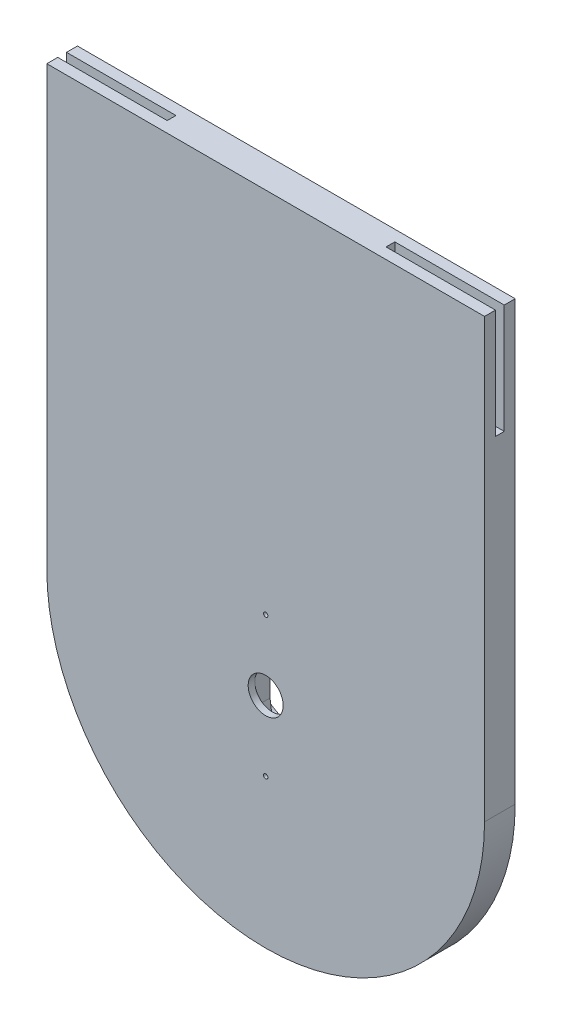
SolidWorks part; units mm, degrees
ref_plane "Front Plane" through (0, 0, 0) normal (0, 0, 1) x (1, 0, 0)
ref_plane "Top Plane" through (0, 0, 0) normal (0, 1, 0) x (1, 0, 0)
ref_plane "Right Plane" through (0, 0, 0) normal (1, 0, 0) x (0, 0, -1)
body saved out of another part "Stock-New base-1"
sketch "Sketch1" plane through (0, 0, 0) normal (0, 1, 0) x (1, 0, 0)
  line L0 (0, -88) -> (0, -81) construction
  line L1 (0, -83.5) -> (25, -83.5)
  line L2 (0, -83.5) -> (0, -85.5)
  line L3 (0, -85.5) -> (25, -85.5)
  line L4 (25, -83.5) -> (25, -85.5)
  line L5 (100, -81) -> (100, -88) construction
  line L6 (100, -85.5) -> (75, -85.5)
  line L7 (100, -85.5) -> (100, -83.5)
  line L8 (100, -83.5) -> (75, -83.5)
  line L9 (75, -85.5) -> (75, -83.5)
  line L10 (100, -88) -> (0, -88) construction
  dimension "D1" = 2
  dimension "D2" = 2.5
  dimension "D3" = 2
  dimension "D4" = 2.5
  dimension "D5" = 25
  dimension "D6" = 25
extrude "Cut-Extrude1" cut sketch "Sketch1" against normal blind 25
